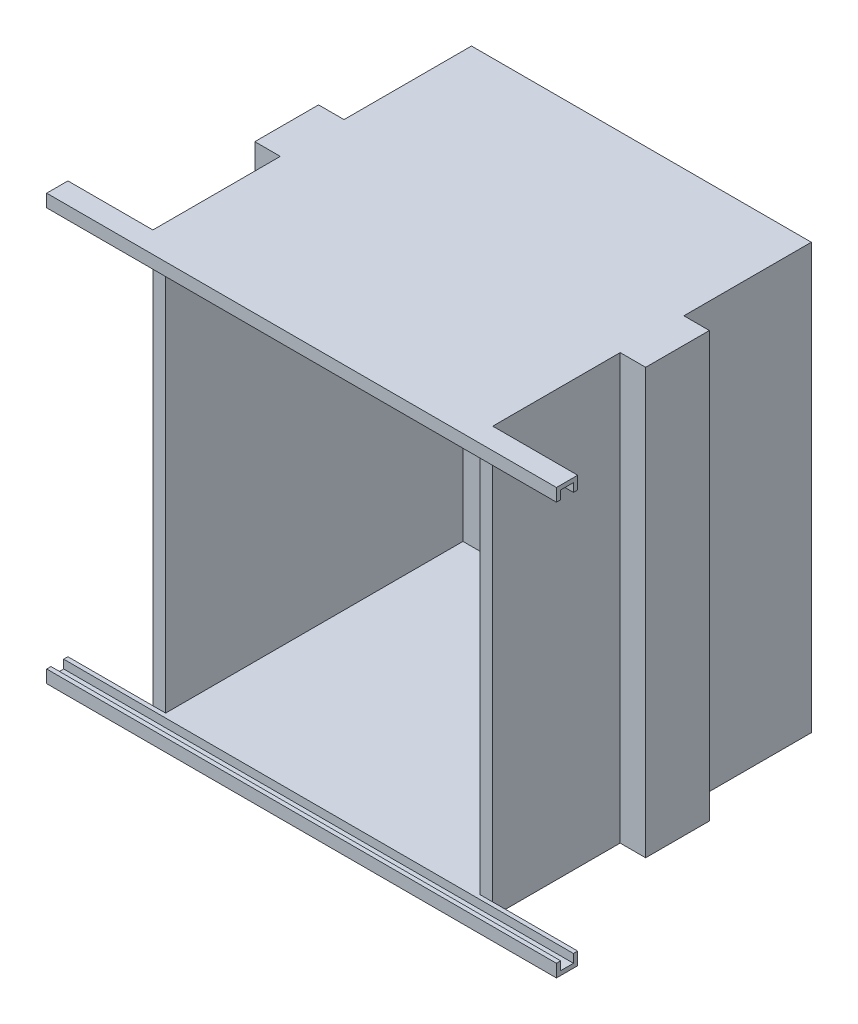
SolidWorks part; units mm, degrees
ref_plane "Plan de face" through (0, 0, 0) normal (0, 0, 1) x (1, 0, 0)
ref_plane "Plan de dessus" through (0, 0, 0) normal (0, 1, 0) x (1, 0, 0)
ref_plane "Plan de droite" through (0, 0, 0) normal (1, 0, 0) x (0, 0, -1)
sketch "Esquisse1" plane through (0, 0, 0) normal (0, 0, 1) x (1, 0, 0)
  line L1 (0, 0) -> (80, 0)
  line L2 (0, 0) -> (0, 100)
  line L3 (0, 100) -> (80, 100)
  line L4 (80, 0) -> (80, 100)
  dimension "D1" = 100
  dimension "D2" = 80
extrude "Boss.-Extru.1" add sketch "Esquisse1" along normal blind 5
sketch "Esquisse2" plane through (0, 0, 5) normal (0, 0, 1) x (1, 0, 0)
  line L1 (0, 100) -> (80, 100)
  line L2 (0, 100) -> (0, 0)
  line L3 (0, 0) -> (80, 0)
  line L4 (80, 100) -> (80, 0)
  line L5 (3, 97) -> (77, 97)
  line L6 (3, 97) -> (3, 3)
  line L7 (3, 3) -> (77, 3)
  line L8 (77, 97) -> (77, 3)
  dimension "D1" = 3
  dimension "D2" = 3
  dimension "D3" = 3
  dimension "D4" = 3
extrude "Boss.-Extru.2" add sketch "Esquisse2" along normal blind 70
sketch "Esquisse3" plane through (0, 0, 75) normal (0, 0, 1) x (1, 0, 0)
  line L0 (80, 0) -> (80, 100) construction
  line L1 (0, 100) -> (80, 100)
  line L2 (0, 100) -> (0, 97)
  line L3 (0, 97) -> (80, 97)
  line L4 (80, 100) -> (80, 97)
  line L5 (3, 3) -> (77, 3) construction
  line L6 (0, 0) -> (80, 0)
  line L7 (0, 0) -> (0, 3)
  line L8 (0, 3) -> (80, 3)
  line L9 (80, 0) -> (80, 3)
  line L10 (77, 97) -> (3, 97) construction
extrude "Boss.-Extru.3" add sketch "Esquisse3" along normal blind 5
sketch "Esquisse4" plane through (80, 0, 0) normal (1, 0, 0) x (0, 0, -1)
  line L0 (-80, 0) -> (0, 0) construction
  line L1 (-80, 100) -> (-75, 100)
  line L2 (-80, 100) -> (-80, 97)
  line L3 (-80, 97) -> (-75, 97)
  line L4 (-75, 100) -> (-75, 97)
  line L5 (-80, 3) -> (-75, 3)
  line L6 (-80, 3) -> (-80, 0)
  line L7 (-80, 0) -> (-75, 0)
  line L8 (-75, 3) -> (-75, 0)
extrude "Boss.-Extru.4" add sketch "Esquisse4" along normal blind 20
sketch "Esquisse5" plane through (0, 0, 0) normal (-1, 0, 0) x (0, 0, 1)
  line L0 (80, 0) -> (0, 0) construction
  line L1 (80, 100) -> (75, 100)
  line L2 (80, 100) -> (80, 97)
  line L3 (80, 97) -> (75, 97)
  line L4 (75, 100) -> (75, 97)
  line L5 (80, 3) -> (75, 3)
  line L6 (80, 3) -> (80, 0)
  line L7 (80, 0) -> (75, 0)
  line L8 (75, 3) -> (75, 0)
extrude "Boss.-Extru.5" add sketch "Esquisse5" along normal blind 20
sketch "Esquisse6" plane through (-20, 0, 0) normal (-1, 0, 0) x (0, 0, 1)
  line L0 (80, 3) -> (75, 3) construction
  line L1 (76, 3) -> (79, 3)
  line L2 (76, 3) -> (76, 1)
  line L3 (76, 1) -> (79, 1)
  line L4 (79, 3) -> (79, 1)
  line L5 (75, 3) -> (75, 0) construction
  line L6 (75, 0) -> (80, 0) construction
  line L7 (75, 97) -> (80, 97) construction
  line L8 (76, 97) -> (79, 97)
  line L9 (76, 97) -> (76, 99)
  line L10 (76, 99) -> (79, 99)
  line L11 (79, 97) -> (79, 99)
  line L12 (75, 100) -> (75, 97) construction
  line L13 (80, 100) -> (75, 100) construction
  point P18 (77.5, 100)
  dimension "D1" = 1
  dimension "D2" = 3
  dimension "D3" = 1
  dimension "D4" = 1
  dimension "D5" = 1
  dimension "D6" = 3
extrude "Enlèv. mat.-Extru.1" cut sketch "Esquisse6" against normal through all
sketch "Esquisse7" plane through (0, 100, 0) normal (0, 1, 0) x (1, 0, 0)
  line L0 (0, -75) -> (0, 0) construction
  line L1 (0, -30) -> (-6, -30)
  line L2 (0, -30) -> (0, -45)
  line L3 (0, -45) -> (-6, -45)
  line L4 (-6, -30) -> (-6, -45)
  line L6 (80, 0) -> (0, 0) construction
  line L8 (80, -75) -> (80, 0) construction
  line L9 (80, -30) -> (86, -30)
  line L10 (80, -30) -> (80, -45)
  line L11 (80, -45) -> (86, -45)
  line L12 (86, -30) -> (86, -45)
  dimension "D1" = 30
  dimension "D2" = 15
  dimension "D3" = 6
  dimension "D4" = 30
  dimension "D5" = 6
  dimension "D6" = 15
extrude "Boss.-Extru.6" add sketch "Esquisse7" against normal up to surface (100 mm away)
